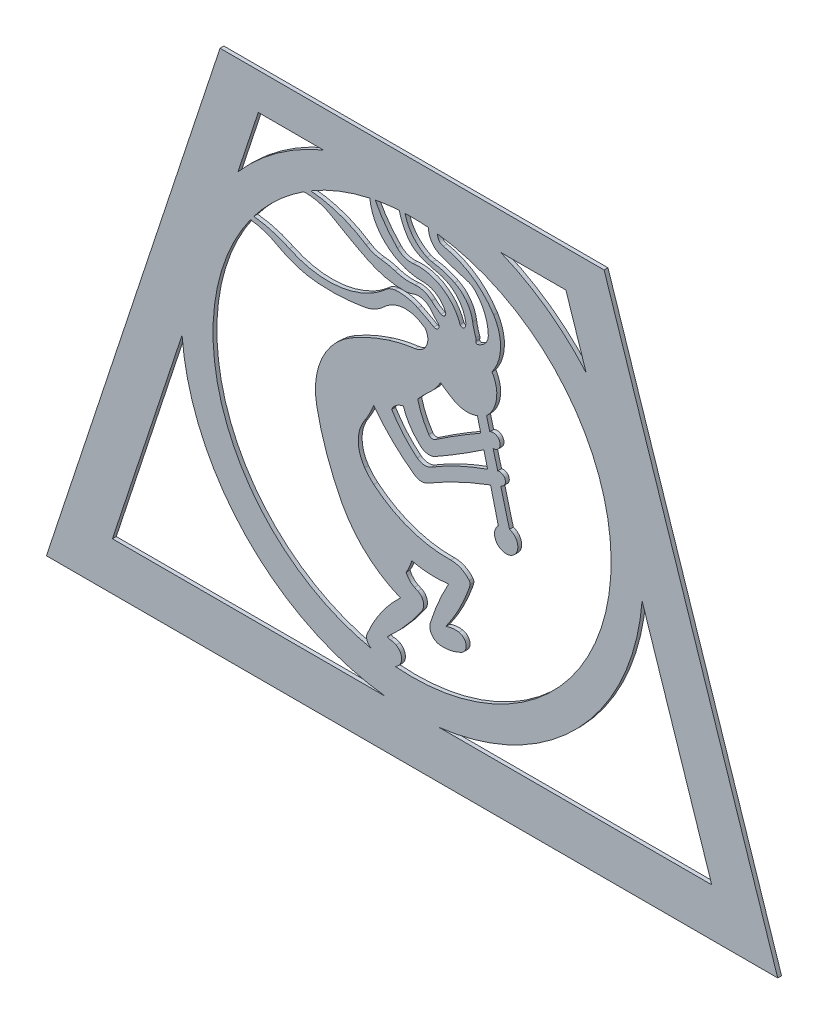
SolidWorks part; units mm, degrees
ref_plane "Front Plane" through (0, 0, 0) normal (0, 0, 1) x (1, 0, 0)
ref_plane "Top Plane" through (0, 0, 0) normal (0, 1, 0) x (1, 0, 0)
ref_plane "Right Plane" through (0, 0, 0) normal (1, 0, 0) x (0, 0, -1)
sketch "Model" plane through (0, 0, 0) normal (0, 0, 1) x (1, 0, 0)
  line L0 (121.8097, -137.6405) -> (107.3418, -82.7355)
  line L1 (68.9055, -1.7853) -> (74.3899, -24.0365)
  line L2 (90.642, -89.9748) -> (103.4341, -141.8749)
  line L3 (102.3813, -63.9103) -> (94.9941, -35.8763)
  line L4 (85.7104, -69.989) -> (85.7156, -69.9871)
  line L5 (107.3418, -82.7355) -> (107.5886, -82.6285)
  line L6 (79.5971, -45.1632) -> (85.7156, -69.9871)
  line L7 (89.3465, -14.4437) -> (84.0088, 5.8125)
  line L8 (-292.6324, 250.7061) -> (-185.3492, 250.7061)
  line L9 (-642.1163, -557.4603) -> (564.3837, -557.4603)
  line L10 (-326.1472, 149.0988) -> (-292.6324, 250.7061)
  line L11 (-642.1163, -557.4603) -> (-355.684, 310.9197)
  line L12 (564.3837, -557.4603) -> (277.9513, 310.9197)
  line L13 (-367.2739, -100.6327) -> (289.5413, -100.6327) construction
  line L14 (107.6166, 250.7061) -> (214.8998, 250.7061)
  line L15 (455.4987, -478.7203) -> (340.6176, -130.4339)
  line L16 (-533.2313, -478.7203) -> (-82.978, -478.7203)
  line L17 (-533.2313, -478.7203) -> (-418.3502, -130.4339)
  line L18 (5.2453, -478.7203) -> (455.4987, -478.7203)
  line L19 (-533.2313, -478.7203) -> (455.4987, -478.7203) construction
  line L21 (-533.2313, -478.7203) -> (-280.9068, 286.2547) construction
  line L22 (248.4146, 149.0988) -> (214.8998, 250.7061)
  line L23 (455.4987, -478.7203) -> (203.1742, 286.2547) construction
  line L25 (-355.684, 310.9197) -> (277.9513, 310.9197)
  arc A0 (95.7332, 155.5808) -> (12.6305, 212.2913) centre (-11.4798, 87.7167) ccw
  arc A1 (8.2558, 196.9794) -> (52.0641, 182.6078) centre (178.4836, 641.9205) ccw
  arc A2 (-29.5648, -27.2149) -> (-5.8467, -3.3002) centre (227.3937, -258.3419) cw
  arc A3 (8.0143, 15.1922) -> (-5.8467, -3.3002) centre (-47.8361, 42.6139) cw
  arc A4 (29.2299, 1.0837) -> (68.9055, -1.7853) centre (52.0641, 41.087) ccw
  arc A5 (29.2299, 1.0837) -> (8.0143, 15.1922) centre (121.9361, 163.4954) cw
  arc A6 (52.0641, 182.6078) -> (65.2981, 174.6762) centre (44.4263, 154.8579) cw
  arc A7 (65.2981, 174.6762) -> (86.8758, 121.8798) centre (8.3347, 120.5878) cw
  arc A8 (-0.6887, -70.7111) -> (-11.2744, -68.6714) centre (-4.9624, -64.4021) cw
  arc A9 (-60.0703, 227.0897) -> (-99.7497, 222.082) centre (-38.8663, -100.6327) ccw
  arc A10 (-46.5893, 196.4008) -> (-60.0703, 227.0897) centre (35.7624, 250.8815) cw
  arc A11 (-14.1146, 183.0061) -> (-50.4739, 227.5698) centre (14.0002, 243.0593) cw
  arc A12 (-46.5893, 196.4008) -> (-24.0961, 178.1484) centre (-6.3186, 223.0423) ccw
  arc A13 (-24.0961, 178.1484) -> (3.9241, 169.7219) centre (39.4106, 338.5236) ccw
  arc A14 (3.9241, 169.7219) -> (49.5503, 123.0035) centre (-8.1491, 112.2919) cw
  arc A15 (12.6305, 212.2913) -> (3.3298, 225.0528) centre (14.8319, 223.6657) cw
  arc A16 (5.2453, -478.7203) -> (340.6176, -130.4339) centre (-38.8663, -100.6327) ccw
  arc A17 (-14.1146, 183.0061) -> (-5.5582, 180.5421) centre (-2.0774, 208.7175) ccw
  arc A18 (-5.5582, 180.5421) -> (31.342, 169.3123) centre (-19.3337, 69.036) cw
  arc A19 (31.342, 169.3123) -> (61.1081, 128.3223) centre (6.3519, 119.8622) cw
  arc A20 (61.1081, 128.3223) -> (66.3204, 107.8468) centre (170.0568, 145.1553) ccw
  arc A21 (66.3204, 107.8468) -> (66.3719, 103.3846) centre (59.91, 105.5413) cw
  arc A22 (66.3719, 103.3846) -> (69.6967, 100.1031) centre (68.8405, 102.5607) ccw
  arc A23 (69.6967, 100.1031) -> (81.0885, 107.3404) centre (59.9886, 127.9683) ccw
  arc A24 (86.8758, 121.8798) -> (81.0885, 107.3404) centre (66.5583, 121.5456) cw
  arc A25 (-103.9493, -422.5267) -> (-113.1901, -404.8498) centre (-100.2902, -409.36) cw
  arc A26 (-65.1573, -396.5896) -> (-67.154, -427.8197) centre (-73.4199, -411.7402) cw
  arc A27 (-65.1573, -396.5896) -> (-75.1065, -393.8665) centre (-75.8921, -416.2735) ccw
  arc A28 (-75.1065, -393.8665) -> (-79.2674, -391.326) centre (-74.9325, -388.9038) cw
  arc A29 (-39.317, -263.2371) -> (-48.6228, -284.1924) centre (-123.7076, -238.305) cw
  arc A30 (-39.317, -263.2371) -> (21.3409, -266.0287) centre (-1.4435, -100.6993) ccw
  arc A31 (-58.002, -325.6124) -> (-154.7207, -237.9942) centre (12.4799, -150.6184) cw
  arc A32 (-154.7207, -237.9942) -> (-196.0476, -120.592) centre (232.0704, -35.8647) cw
  arc A33 (-196.0476, -120.592) -> (-139.8027, 5.0686) centre (-79.2116, -97.4694) cw
  arc A34 (-139.8027, 5.0686) -> (-77.4813, 32.9433) centre (14.0327, -255.266) cw
  arc A35 (-77.4813, 32.9433) -> (-33.8564, 42.5936) centre (-2.052, -204.6097) cw
  arc A36 (-33.8564, 42.5936) -> (-16.4133, 79.074) centre (-36.9286, 66.473) ccw
  arc A37 (-16.4133, 79.074) -> (-18.4846, 80.9218) centre (-20.5275, 76.5469) ccw
  arc A38 (-18.4846, 80.9218) -> (-21.9659, 82.9295) centre (-8.6161, 102.0558) cw
  arc A39 (-21.9659, 82.9295) -> (-65.2774, 88.8876) centre (-49.4478, 43.5563) ccw
  arc A40 (-65.2774, 88.8876) -> (-85.2911, 76.5469) centre (-47.242, 37.2396) ccw
  arc A41 (-305.4745, 91.1267) -> (-103.9493, -422.5267) centre (-38.8663, -100.6327) ccw
  arc A42 (-418.3502, -130.4339) -> (-82.978, -478.7203) centre (-38.8663, -100.6327) ccw
  arc A43 (248.4146, 149.0988) -> (107.6166, 250.7061) centre (-38.8663, -100.6327) ccw
  arc A44 (-185.3492, 250.7061) -> (-326.1472, 149.0988) centre (-38.8663, -100.6327) ccw
  arc A45 (-106.7263, 85.4991) -> (-82.2289, 102.979) centre (-170.3417, 200.5596) ccw
  arc A46 (-82.2289, 102.979) -> (-67.154, 109.7518) centre (-64.1994, 83.0122) cw
  arc A47 (-67.154, 109.7518) -> (-29.2788, 102.979) centre (-59.69, 42.2021) cw
  arc A48 (-29.2788, 102.979) -> (-2.9225, 88.8876) centre (-276.6601, -391.4134) cw
  arc A49 (-2.9225, 88.8876) -> (3.9241, 97.8754) centre (-0.1003, 93.8394) ccw
  arc A50 (3.9241, 97.8754) -> (-8.1491, 111.4066) centre (113.7905, 208.056) cw
  arc A51 (-8.1491, 111.4066) -> (-36.9286, 119.0901) centre (-27.7021, 95.9088) ccw
  arc A52 (-36.9286, 119.0901) -> (-51.4493, 116.2754) centre (-51.6135, 155.9855) cw
  arc A53 (-51.4493, 116.2754) -> (-112.4405, 130.625) centre (-52.0051, 250.7061) cw
  arc A54 (-217.5362, 174.9188) -> (-299.9658, 98.5622) centre (-38.8663, -100.6327) ccw
  arc A58 (-114.7512, 150.5139) -> (-90.2904, 141.9589) centre (-85.6103, 194.5877) ccw
  arc A59 (-90.2904, 141.9589) -> (-67.154, 137.1455) centre (-99.3003, 40.6406) cw
  arc A60 (-67.154, 137.1455) -> (-34.073, 133.5994) centre (-42.4848, 211.2037) ccw
  arc A61 (-34.073, 133.5994) -> (-6.7662, 124.4171) centre (-30.3684, 99.422) cw
  arc A62 (-6.7662, 124.4171) -> (8.8424, 113.1799) centre (43.1097, 177.2363) ccw
  arc A63 (8.8424, 113.1799) -> (16.2992, 119.9774) centre (11.367, 117.8992) ccw
  arc A64 (16.2992, 119.9774) -> (-21.2664, 144.7136) centre (-20.9675, 104.2748) ccw
  arc A65 (-21.2664, 144.7136) -> (-90.1684, 176.7529) centre (-21.922, 233.4119) cw
  arc A66 (-63.5232, 171.9975) -> (-99.7497, 222.082) centre (81.7961, 315.252) cw
  arc A67 (-90.1684, 176.7529) -> (-108.5768, 220.291) centre (-27.1821, 229.0448) cw
  arc A68 (-63.5232, 171.9975) -> (-36.9861, 162.6656) centre (-40.703, 194.4934) ccw
  arc A69 (-36.9861, 162.6656) -> (40.2486, 114.424) centre (-28.53, 90.2567) cw
  arc A70 (49.5503, 123.0035) -> (48.3769, 113.9977) centre (35.0563, 120.3128) cw
  arc A71 (48.3769, 113.9977) -> (40.2486, 114.424) centre (44.4004, 115.8829) cw
  arc A72 (-58.002, -325.6124) -> (-113.1901, -404.8498) centre (97.7212, -492.9098) ccw
  arc A73 (-79.2674, -391.326) -> (-22.7857, -326.5913) centre (-310.6788, -132.4094) ccw
  arc A74 (-48.6228, -284.1924) -> (-35.1582, -298.8332) centre (-21.9385, -273.1636) ccw
  arc A75 (-29.2494, -301.3735) -> (-22.7857, -326.5913) centre (-37.2219, -316.8542) cw
  arc A76 (-35.1582, -298.8332) -> (-29.2494, -301.3735) centre (-13.9659, -257.6829) ccw
  arc A77 (-102.1873, -72.5597) -> (-117.7533, -102.7718) centre (-242.6554, -19.3028) cw
  arc A78 (-117.7533, -102.7718) -> (-117.1516, -169.0232) centre (-68.8449, -135.456) ccw
  arc A79 (-117.1516, -169.0232) -> (-102.0583, -185.5478) centre (-47.7945, -120.8287) ccw
  arc A80 (-102.0583, -185.5478) -> (24.972, -230.0372) centre (20.3987, -39.4962) ccw
  arc A81 (24.972, -230.0372) -> (55.3056, -244.0475) centre (25.8811, -267.9117) cw
  arc A82 (55.3056, -244.0475) -> (56.744, -249.4103) centre (50.0105, -248.342) cw
  arc A83 (56.744, -249.4103) -> (55.3056, -255.0798) centre (24.9953, -244.3729) cw
  arc A84 (55.3056, -255.0798) -> (16.7788, -329.0067) centre (-224.6282, -156.1955) cw
  arc A85 (-102.1873, -72.5597) -> (-35.0493, -138.1164) centre (139.6179, 107.9208) ccw
  arc A86 (79.5977, -45.1627) -> (-0.7426, -94.9983) centre (-592.0382, 947.9108) cw
  arc A87 (85.7104, -69.989) -> (-7.2272, -113.3575) centre (245.7713, -534.2617) ccw
  arc A88 (90.6542, -89.9703) -> (-12.9594, -139.0475) centre (308.4973, -683.8043) ccw
  arc A89 (-72.6043, -63.3833) -> (-30.5887, -111.6475) centre (91.426, 36.9906) ccw
  arc A90 (-53.219, -49.1619) -> (-23.8984, -92.827) centre (38.3218, -19.3701) ccw
  arc A91 (21.3409, -266.0287) -> (-8.6819, -336.3688) centre (357.7436, -451.1909) ccw
  arc A92 (103.4341, -141.8749) -> (121.8097, -137.6405) centre (116.3925, -156.1205) ccw
  arc A93 (101.7377, -64.1489) -> (107.5886, -82.6285) centre (105.439, -73.1431) cw
  arc A94 (88.6254, -14.8973) -> (95.4492, -35.6339) centre (95.0312, -24.2804) cw
  arc A95 (-53.219, -49.1619) -> (-72.6043, -63.3833) centre (-49.3957, -74.6964) ccw
  arc A96 (-35.0493, -138.1164) -> (-12.9594, -139.0475) centre (-23.2863, -121.547) ccw
  arc A97 (-7.2272, -113.3575) -> (-30.5887, -111.6475) centre (-17.6958, -95.9413) cw
  arc A98 (-0.7426, -94.9983) -> (-23.8984, -92.827) centre (-10.7648, -77.3215) cw
  arc A99 (-67.154, -427.8197) -> (3.3298, 225.0528) centre (-38.8663, -100.6327) ccw
  arc A100 (74.3848, -24.0394) -> (74.3899, -24.0365) centre (-3.546, 113.0154) ccw
  arc A101 (94.9941, -35.8763) -> (95.4492, -35.6339) centre (176.6494, -188.6622) cw
  arc A102 (-8.6819, -336.3688) -> (8.0619, -360.5258) centre (9.0842, -341.9359) ccw
  arc A103 (8.0619, -360.5258) -> (42.8516, -352.9631) centre (11.7399, -293.6444) ccw
  arc A104 (42.8516, -352.9631) -> (38.535, -326.4051) centre (36.2645, -340.404) ccw
  arc A105 (38.535, -326.4051) -> (16.7788, -329.0067) centre (32.1839, -365.5637) ccw
  arc A106 (8.2558, 196.9794) -> (-11.7911, 226.657) centre (19.4044, 226.1197) cw
  arc A107 (-108.5768, 220.291) -> (-206.0886, 182.0125) centre (-38.8663, -100.6327) ccw
  arc A108 (-11.7911, 226.657) -> (-50.4739, 227.5698) centre (-38.8663, -100.6327) ccw
  arc A109 (-106.7263, 85.4991) -> (-241.1459, 81.8505) centre (-177.4581, 213.4308) cw
  arc A110 (-241.1459, 81.8505) -> (-299.9658, 98.5622) centre (-318.1026, -77.1433) ccw
  arc A111 (-85.2911, 76.5469) -> (-117.7148, 60.0232) centre (-128.4188, 121.1009) cw
  arc A112 (-117.7148, 60.0232) -> (-193.9003, 56.0871) centre (-171.8761, 369.0725) cw
  arc A113 (-193.9003, 56.0871) -> (-260.8316, 76.5469) centre (-182.9576, 211.593) cw
  arc A114 (-260.8316, 76.5469) -> (-305.4745, 91.1267) centre (-317.7956, -22.2377) ccw
  arc A115 (-114.7512, 150.5139) -> (-206.0886, 182.0125) centre (-221.561, -11.0296) ccw
  arc A116 (-112.4405, 130.625) -> (-170.3417, 162.6656) centre (267.6022, 885.7442) cw
  arc A117 (-170.3417, 162.6656) -> (-217.5362, 174.9188) centre (-214.4284, 89.8752) ccw
  arc A147 (93.0134, 72.9708) -> (95.7332, 155.5808) centre (33.6379, 116.2754) ccw
  arc A148 (-29.5648, -27.2149) -> (-11.2744, -68.6714) centre (94.0123, 2.5434) ccw
  arc A149 (-0.6887, -70.7111) -> (74.3848, -24.0394) centre (632.0172, -1004.7314) cw
  arc A329 (93.0134, 72.9708) -> (84.0088, 5.8125) centre (47.2696, 44.9213) cw
  point P54 (82.1503, 147.451)
  dimension "D1" = 7.6203
  dimension "D2" = 20.3203
  dimension "D3" = 20.3203
  dimension "D8" = 78.74
  dimension "D5" = 1206.5
  dimension "D7" = 914.4
extrude "Boss-Extrude1" add sketch "Model" along normal blind 6.35
